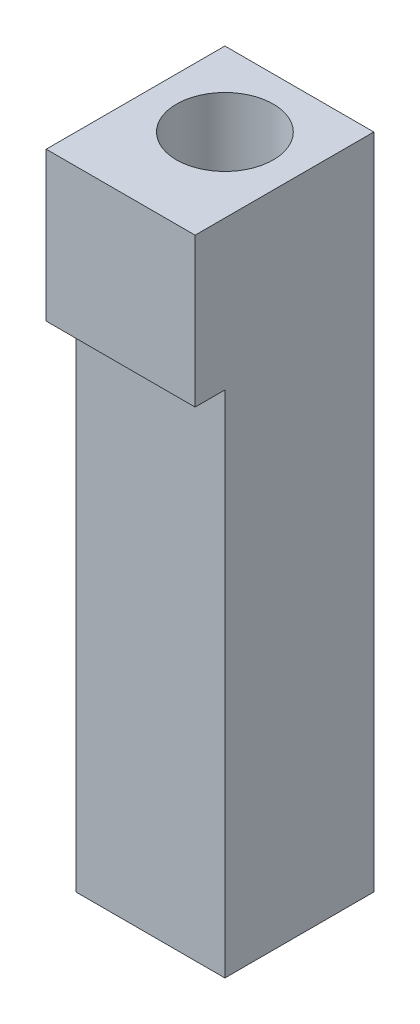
SolidWorks part; units mm, degrees
ref_plane "前视基准面" through (0, 0, 0) normal (0, 0, 1) x (1, 0, 0)
ref_plane "上视基准面" through (0, 0, 0) normal (0, 1, 0) x (1, 0, 0)
ref_plane "右视基准面" through (0, 0, 0) normal (1, 0, 0) x (0, 0, -1)
sketch "草图1" plane through (0, 0, 0) normal (0, 0, 1) x (1, 0, 0)
  line L0 (10, 0) -> (10, 44.2)
  line L1 (0, 0) -> (0, 44.2)
  line L2 (0, 0) -> (10, 0)
  line L3 (0, 44.2) -> (10, 44.2)
extrude "凸台-拉伸1" add sketch "草图1" along normal blind 12
sketch "草图2" plane through (10, 0, 0) normal (1, 0, 0) x (0, 0, -1)
  line L0 (-12, 34.2) -> (-12, 44.2)
  line L1 (0, 0) -> (0, 44.2)
  line L2 (-12, 34.2) -> (-10, 34.2)
  line L3 (-12, 44.2) -> (0, 44.2)
  line L4 (-10, 0) -> (0, 0)
  line L5 (-10, 0) -> (-10, 34.2)
extrude "切除-拉伸1" cut sketch "草图2" against normal through all flip side to cut
sketch "草图3" plane through (0, 44.2, 0) normal (0, 1, 0) x (1, 0, 0)
  circle A0 centre (5, -5) radius 3.25
extrude "切除-拉伸2" cut sketch "草图3" against normal blind 5
